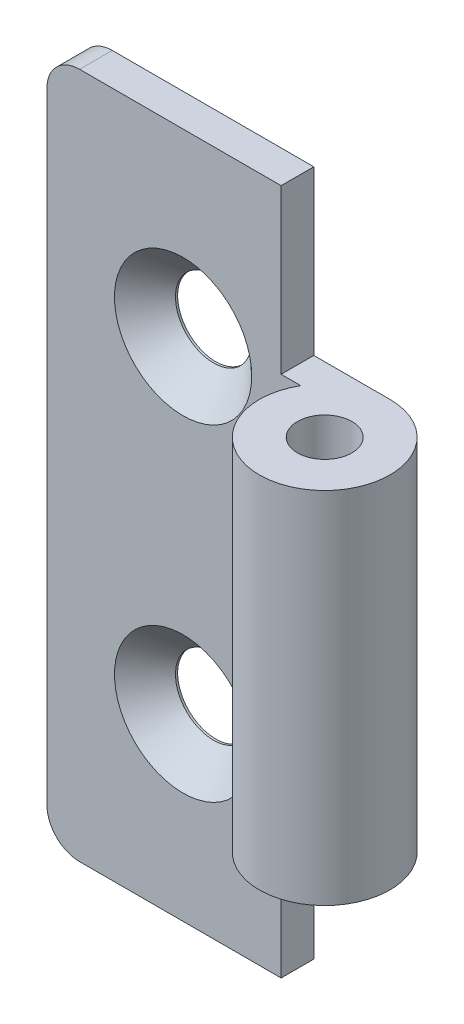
SolidWorks part; units mm, degrees
ref_plane "正面" through (0, 0, 0) normal (0, 0, 1) x (1, 0, 0)
ref_plane "平面" through (0, 0, 0) normal (0, 1, 0) x (1, 0, 0)
ref_plane "右側面" through (0, 0, 0) normal (1, 0, 0) x (0, 0, -1)
sketch "ｽｹｯﾁ1" plane through (0, 0, 0) normal (0, 1, 0) x (1, 0, 0)
  line L0 (0, 6) -> (-28.5, 6)
  line L1 (-28.5, 6) -> (-28.5, 3)
  line L2 (-28.5, 3) -> (-5.1962, 3)
  arc A0 (-5.1962, 3) -> (0, 6) centre (0, 0) ccw
  dimension "D1" = 3
  dimension "D2" = 12
  dimension "D3" = 28.5
extrude "押し出し1" add sketch "ｽｹｯﾁ1" along normal blind 63
sketch "ｽｹｯﾁ2" plane through (0, 0, -6) normal (0, 0, -1) x (-1, 0, 0)
  line L0 (0, 63) -> (28.5, 63) construction
  line L1 (-13.5139, 48) -> (7, 48)
  line L2 (-6, 63) -> (-6, 0) construction
  line L3 (-13.5139, 15) -> (7, 15)
  line L4 (-13.5139, 15) -> (-13.5139, 0)
  line L5 (0, 0) -> (28.5, 0) construction
  line L7 (7, 15) -> (7, 0)
  line L8 (7, 0) -> (-13.5139, 0)
  line L9 (-13.5139, 48) -> (-13.5139, 63)
  line L10 (-13.5139, 63) -> (7, 63)
  line L11 (7, 48) -> (7, 63)
  line L12 (-6, 63) -> (-6, 0) construction
  dimension "D1" = 15
  dimension "D2" = 15
  dimension "D3" = 13
  dimension "D4" = 13
extrude "押し出し2" cut sketch "ｽｹｯﾁ2" against normal through all
fillet "ﾌｨﾚｯﾄ1" radius 3 2 edges at (-28.5, 0, -4.5) (-28.5, 63, -4.5)
hole_wizard "M6 平皿頭ねじ用皿穴1" positions "ｽｹｯﾁ4" profile "ｽｹｯﾁ3" countersink size "M6" standard "JIS"
sketch "ｽｹｯﾁ4" plane through (0, 0, -3) normal (0, 0, 1) x (1, 0, 0)
  line L0 (-25.5, 63) -> (-7, 63) construction
  line L1 (-28.5, 60) -> (-28.5, 3) construction
  point P0 (-16, 46.5)
  point P1 (-16, 16.5)
  dimension "D1" = 16.5
  dimension "D2" = 30
  dimension "D3" = 12.5
sketch "ｽｹｯﾁ3" plane through (-16, 46.5, -3) normal (1, 0, 0) x (0, -1, 0)
  line L0 (0, 0) -> (0, 3)
  line L1 (0, 3) -> (3.5, 3)
  line L2 (3.5, 3) -> (3.5, 2.8)
  line L3 (3.5, 2.8) -> (6.3, 0)
  line L5 (6.3, 0) -> (0, 0)
  line L6 (-3.5, 2.8) -> (-6.3, 0) construction
  line L11 (0, -6.35) -> (0, 107.95) construction
  dimension "通し穴の直径" = 7
  dimension "通し穴の深さ" = 3
  dimension "表面の皿穴の直径" = 12.6
  dimension "表面の皿穴の角度" = 90
sketch "ｽｹｯﾁ5" plane through (0, 48, 0) normal (0, 1, 0) x (1, 0, 0)
  circle A0 centre (0, 0) radius 2.5
extrude "押し出し3" cut sketch "ｽｹｯﾁ5" against normal through all
